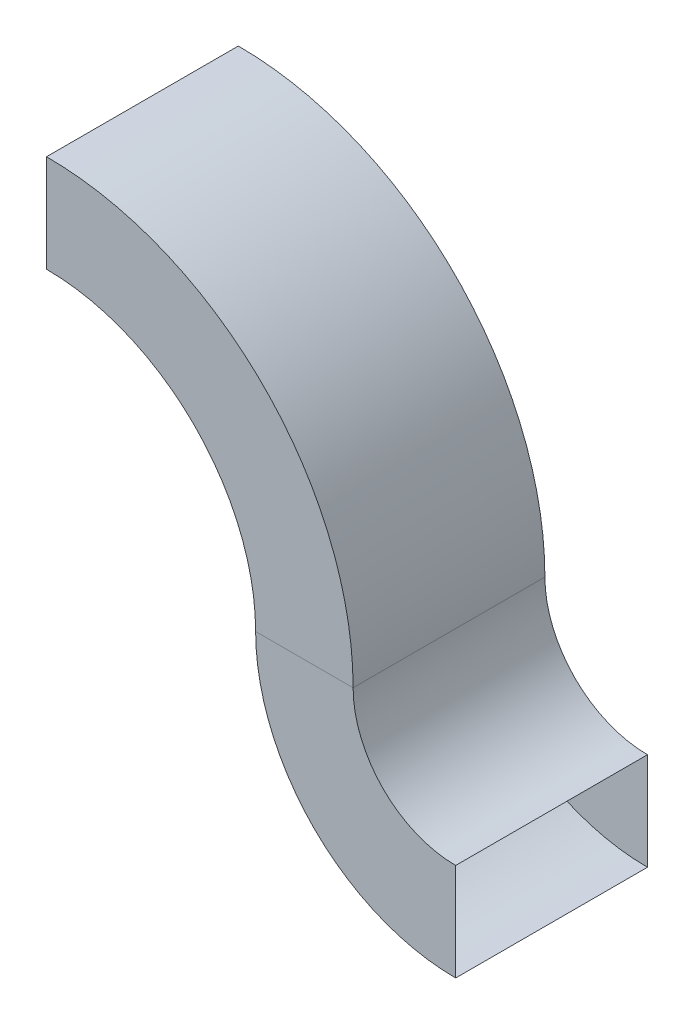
SolidWorks part; units mm, degrees
ref_plane "Front" through (0, 0, 0) normal (0, 0, 1) x (1, 0, 0)
ref_plane "Top" through (0, 0, 0) normal (0, 1, 0) x (1, 0, 0)
ref_plane "Right" through (0, 0, 0) normal (1, 0, 0) x (0, 0, -1)
sketch "Sketch1" plane through (0, 0, 0) normal (0, 0, 1) x (1, 0, 0)
  arc A0 (0, 0) -> (46.7537, -46.7537) centre (0, -46.7537) cw
  arc A1 (46.7537, -46.7537) -> (91.4841, -91.4841) centre (91.4841, -46.7537) ccw
sketch "Sketch2" plane through (0, 0, 0) normal (1, 0, 0) x (0, 0, -1)
  line L1 (-21.4407, 21.7942) -> (21.4407, 21.7942)
  line L2 (-21.4407, 21.7942) -> (-21.4407, 0)
  line L3 (-21.4407, 0) -> (21.4407, 0)
  line L4 (21.4407, 21.7942) -> (21.4407, 0)
surface "Surface-Sweep3"
